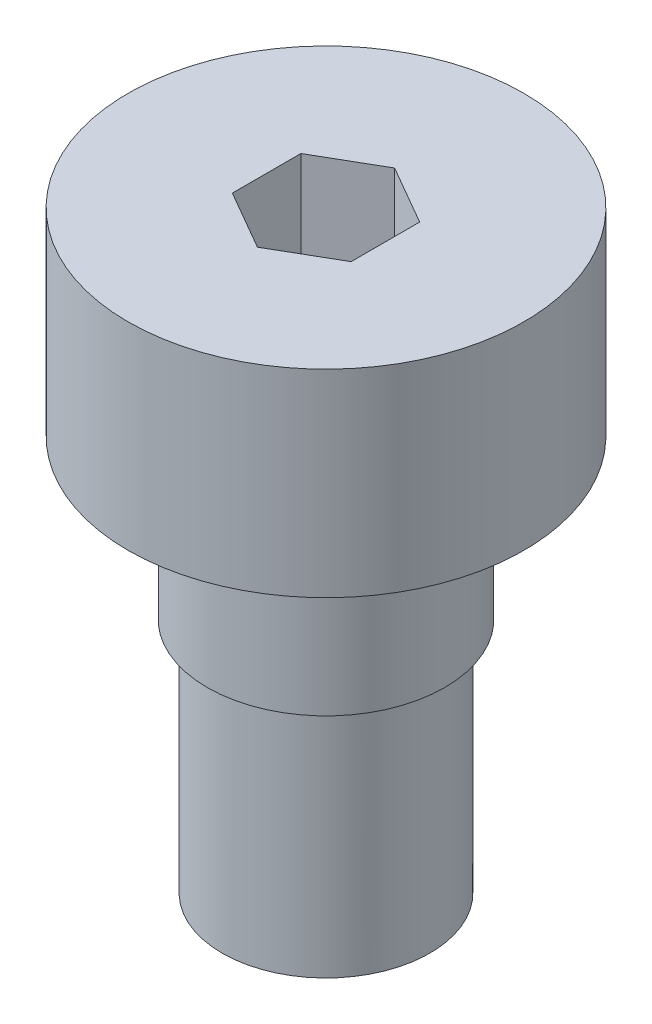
SolidWorks part; units mm, degrees
ref_plane "Front Plane" through (0, 0, 0) normal (0, 0, 1) x (1, 0, 0)
ref_plane "Top Plane" through (0, 0, 0) normal (0, 1, 0) x (1, 0, 0)
ref_plane "Right Plane" through (0, 0, 0) normal (1, 0, 0) x (0, 0, -1)
sketch "Sketch1" plane through (0, 0, 0) normal (0, 1, 0) x (1, 0, 0)
  circle A0 centre (0, 0) radius 3.9688
  dimension "D1" = 7.9375
extrude "Boss-Extrude1" add sketch "Sketch1" along normal blind 3.9688
sketch "Sketch2" plane through (0, 0, 0) normal (0, 1, 0) x (1, 0, 0)
  circle A0 centre (0, 0) radius 2.3813
  dimension "D1" = 4.7625
extrude "Boss-Extrude2" add sketch "Sketch2" against normal blind 3.175
sketch "Sketch3" plane through (0, -3.175, 0) normal (0, -1, 0) x (1, 0, 0)
  circle A0 centre (0, 0) radius 2.0828
  dimension "D1" = 4.1656
extrude "Boss-Extrude3" add sketch "Sketch3" along normal blind 4.7625
sketch "Sketch4" plane through (0, 3.9688, 0) normal (0, 1, 0) x (1, 0, 0)
  line L1 (0, 1.3748) -> (-1.1906, 0.6874)
  line L2 (-1.1906, 0.6874) -> (-1.1906, -0.6874)
  line L3 (-1.1906, -0.6874) -> (0, -1.3748)
  line L4 (0, -1.3748) -> (1.1906, -0.6874)
  line L5 (1.1906, -0.6874) -> (1.1906, 0.6874)
  line L6 (1.1906, 0.6874) -> (0, 1.3748)
  circle A0 centre (0, 0) radius 1.1906 construction
  dimension "D1" = 2.3813
extrude "Cut-Extrude1" cut sketch "Sketch4" against normal blind 3.9688
